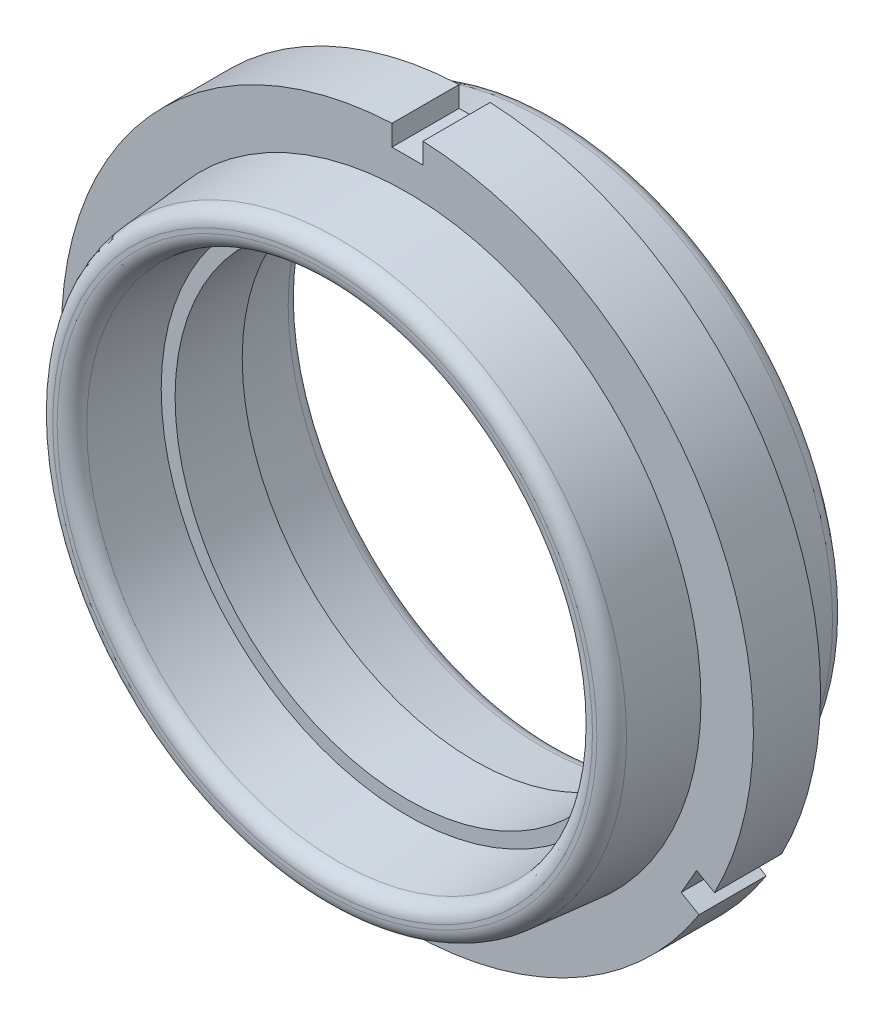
SolidWorks part; units mm, degrees
ref_plane "Face" through (0, 0, 0) normal (0, 0, 1) x (1, 0, 0)
ref_plane "Dessus" through (0, 0, 0) normal (0, 1, 0) x (1, 0, 0)
ref_plane "Droite" through (0, 0, 0) normal (1, 0, 0) x (0, 0, -1)
sketch "Esquisse1" plane through (0, 0, 0) normal (0, 0, 1) x (1, 0, 0)
  circle A0 centre (0, 0) radius 67
  circle A1 centre (0, 0) radius 45
  dimension "D1" = 134
  dimension "D2" = 90
extrude "Extrusion1" add sketch "Esquisse1" along normal blind 13
sketch "Esquisse2" plane through (0, 0, 13) normal (0, 0, 1) x (1, 0, 0)
  line L0 (0, 0) -> (0, 81.0121) construction
  line L1 (3, 66.9328) -> (3, 62.9328)
  line L2 (3, 62.9328) -> (-3, 62.9328)
  line L3 (-3, 66.9328) -> (-3, 62.9328)
  line L4 (56.4655, -36.0645) -> (53.0014, -34.0645)
  line L5 (53.0014, -34.0645) -> (56.0014, -28.8683)
  line L6 (59.4655, -30.8683) -> (56.0014, -28.8683)
  line L7 (-59.4655, -30.8683) -> (-56.0014, -28.8683)
  line L8 (-56.0014, -28.8683) -> (-53.0014, -34.0645)
  line L9 (-56.4655, -36.0645) -> (-53.0014, -34.0645)
  circle A0 centre (0, 0) radius 67 construction
  arc A1 (3, 66.9328) -> (-3, 66.9328) centre (0, 0) ccw
  arc A2 (56.4655, -36.0645) -> (59.4655, -30.8683) centre (0, 0) ccw
  arc A3 (-59.4655, -30.8683) -> (-56.4655, -36.0645) centre (0, 0) ccw
  point P10 (0, 62.9328)
  point P16 (54.5014, -31.4664)
  point P22 (-54.5014, -31.4664)
  dimension "D1" = 6
  dimension "D2" = 4
extrude "Enlèv. mat.-Extru.1" cut sketch "Esquisse2" against normal through all
sketch "Esquisse3" plane through (0, 0, 13) normal (0, 0, 1) x (1, 0, 0)
  circle A0 centre (0, 0) radius 47.6896
  circle A1 centre (0, 0) radius 56.8393
extrude "Extrusion2" add sketch "Esquisse3" along normal blind 16 draft 5
sketch "Esquisse4" plane through (0, 0, 0) normal (0, 0, -1) x (-1, 0, 0)
  circle A0 centre (0, 0) radius 57.2199
  circle A1 centre (0, 0) radius 48.1976
extrude "Extrusion3" add sketch "Esquisse4" along normal blind 16 draft 5
fillet "Congé1" radius 3
